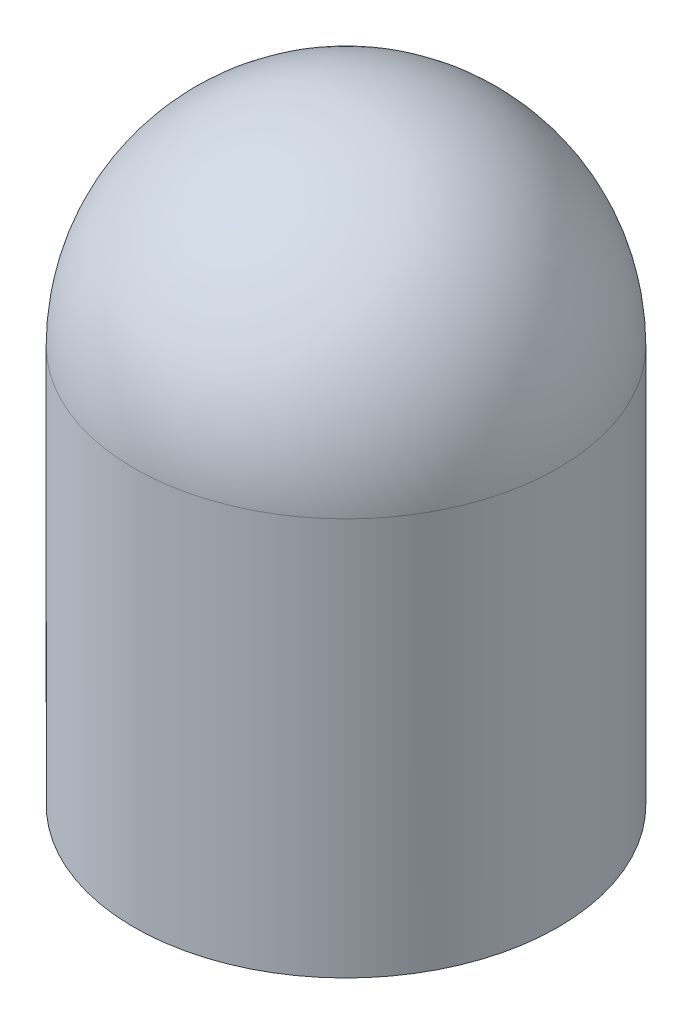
SolidWorks part; units mm, degrees
ref_plane "Front Plane" through (0, 0, 0) normal (0, 0, 1) x (1, 0, 0)
ref_plane "Top Plane" through (0, 0, 0) normal (0, 1, 0) x (1, 0, 0)
ref_plane "Right Plane" through (0, 0, 0) normal (1, 0, 0) x (0, 0, -1)
sketch "Sketch1" plane through (0, 0, 0) normal (0, 0, 1) x (1, 0, 0)
  line L0 (-62.992, 0) -> (-62.992, -118.11)
  line L1 (-62.992, -118.11) -> (0, -118.11)
  line L3 (0, 0) -> (0, 62.992) construction
  line L4 (0, 62.992) -> (0, -118.11)
  arc A0 (0, 62.992) -> (-62.992, 0) centre (0, 0) ccw
  dimension "D1" = 125.984
  dimension "D2" = 181.102
revolve "Revolve1" add sketch "Sketch1" angle 360 about L3
